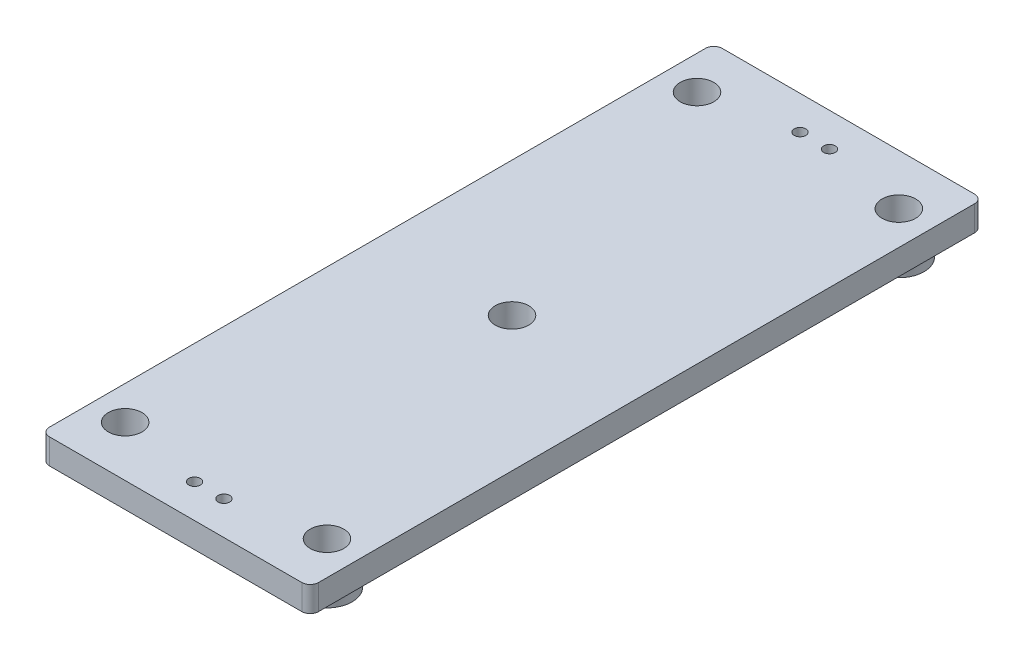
SolidWorks part; units mm, degrees
ref_plane "front" through (0, 0, 0) normal (0, 0, 1) x (1, 0, 0)
ref_plane "top" through (0, 0, 0) normal (0, 1, 0) x (1, 0, 0)
ref_plane "side" through (0, 0, 0) normal (1, 0, 0) x (0, 0, -1)
sketch "Sketch1" plane through (0, 0, 0) normal (0, 1, 0) x (1, 0, 0)
  line L0 (101.6, 0) -> (-101.6, 0)
  line L1 (101.6, 0) -> (101.6, -508)
  line L2 (-101.6, -508) -> (101.6, -508)
  line L3 (-101.6, -508) -> (-101.6, 0)
  line L4 (0, 0) -> (0, -508) construction
  dimension "D1" = 508
  dimension "D2" = 203.2
extrude "Base-Extrude" add sketch "Sketch1" along normal blind 19.05
sketch "Sketch2" plane through (0, 0, 0) normal (0, -1, 0) x (1, 0, 0)
  line L0 (0, 508) -> (0, 254) construction
  line L1 (-101.6, 508) -> (101.6, 508) construction
  line L2 (101.6, 254) -> (0, 254) construction
  line L3 (101.6, 0) -> (101.6, 508) construction
  circle A0 centre (76.2, 469.9) radius 19.05
  circle A1 centre (76.2, 38.1) radius 19.05
  circle A2 centre (-76.2, 38.1) radius 19.05
  circle A3 centre (-76.2, 469.9) radius 19.05
  dimension "D2" = 38.1
  dimension "D1" = 38.1
  dimension "D3" = 152.4
extrude "Boss-Extrude1" add sketch "Sketch2" along normal blind 12.7
sketch "Sketch3" plane through (0, -12.7, 0) normal (0, -1, 0) x (1, 0, 0)
  circle A0 centre (76.2, 469.9) radius 12.7
  circle A2 centre (-76.2, 469.9) radius 12.7
  circle A3 centre (76.2, 38.1) radius 12.7
  circle A4 centre (-76.2, 38.1) radius 12.7
  circle A5 centre (-76.2, 38.1) radius 19.05 construction
  circle A6 centre (76.2, 38.1) radius 19.05 construction
  dimension "D1" = 25.4
extrude "Cut-Extrude1" cut sketch "Sketch3" against normal through all
sketch "Sketch4" plane through (0, 19.05, 0) normal (0, 1, 0) x (-1, 0, 0)
  line L0 (0, 254) -> (-101.6, 254) construction
  line L1 (-101.6, 0) -> (-101.6, 508) construction
  circle A0 centre (0, 254) radius 12.7
  dimension "D1" = 25.4
extrude "Cut-Extrude2" cut sketch "Sketch4" against normal through all
sketch "Sketch5" plane through (0, 0, 0) normal (0, -1, 0) x (1, 0, 0)
  line L0 (0, 254) -> (172.0454, 254) construction
  circle A0 centre (-11.1125, 25.4) radius 4.3656
  circle A1 centre (11.1125, 25.4) radius 4.3656
  circle A2 centre (11.1125, 482.6) radius 4.3656
  circle A3 centre (-11.1125, 482.6) radius 4.3656
  dimension "D1" = 8.7312
extrude "Cut-Extrude3" cut sketch "Sketch5" against normal through all
fillet "Fillet1" radius 6.35 4 edges at (101.6, 9.525, 0) (-101.6, 9.525, 0) (-101.6, 9.525, 508) (101.6, 9.525, 508)
fillet "Fillet2" radius 3.175 4 edges at (76.2, 0, 450.85) (76.2, 0, 19.05) (-76.2, 0, 19.05) (-76.2, 0, 450.85)
